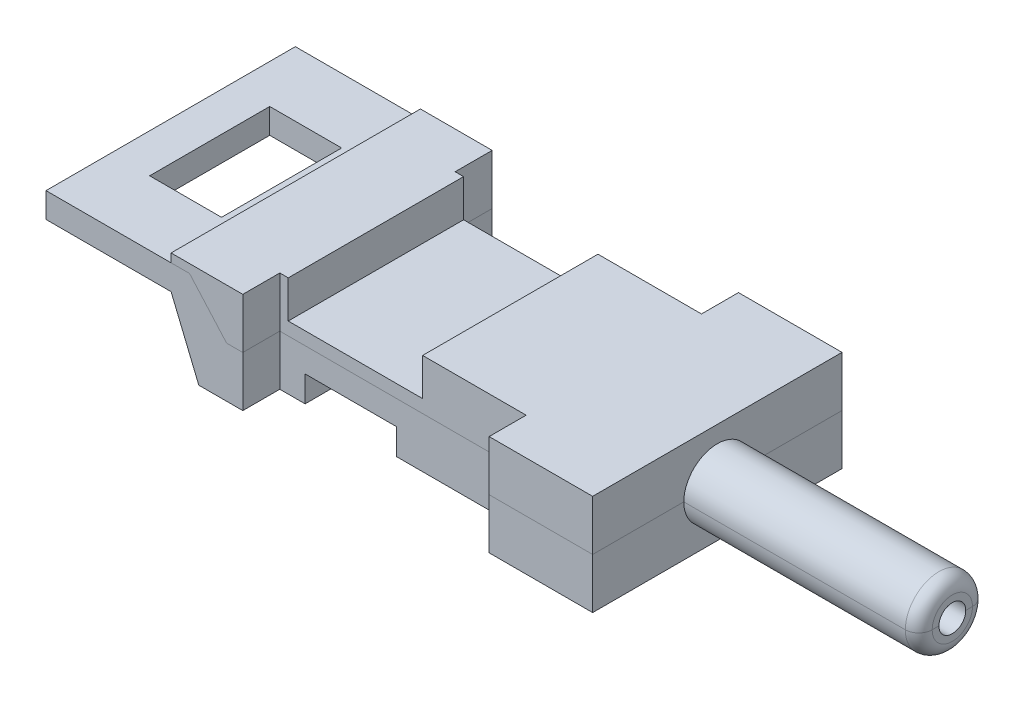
SolidWorks part; units mm, degrees
ref_plane "Ebene vorne" through (0, 0, 0) normal (0, 0, 1) x (1, 0, 0)
ref_plane "Ebene oben" through (0, 0, 0) normal (0, 1, 0) x (1, 0, 0)
ref_plane "Ebene rechts" through (0, 0, 0) normal (1, 0, 0) x (0, 0, -1)
sketch "Skizze1" plane through (0, 0, 0) normal (0, 1, 0) x (1, 0, 0)
  line L0 (40.7087, 0) -> (-40.7087, 0) construction
  line L1 (-40.7087, 18.5695) -> (40.7087, 18.5695)
  line L2 (-40.7087, 18.5695) -> (-40.7087, -18.5695)
  line L3 (-40.7087, -18.5695) -> (40.7087, -18.5695)
  line L4 (40.7087, 18.5695) -> (40.7087, -18.5695)
extrude "Linear austragen1" add sketch "Skizze1" along normal blind 5 and the other way blind 10
sketch "Skizze2" plane through (0, 0, 18.5695) normal (0, 0, 1) x (1, 0, 0)
  line L0 (-40.7087, 0) -> (-22.0775, 0)
  line L1 (-40.7087, 5) -> (-40.7087, -10) construction
  line L2 (-22.0775, 0) -> (-17.9491, -10)
  line L3 (-40.7087, -10) -> (40.7087, -10) construction
  line L4 (-10.1413, 5) -> (-10.1413, -0.5705)
  line L5 (-40.7087, 5) -> (40.7087, 5) construction
  line L6 (-10.1413, -0.5705) -> (9.872, -0.5705)
  line L7 (9.872, -0.5705) -> (9.872, 5)
  line L8 (-7.6284, -10) -> (-7.6284, -6.1347)
  line L9 (-7.6284, -6.1347) -> (6.013, -6.1347)
  line L10 (6.013, -6.1347) -> (6.013, -10)
  line L11 (-10.1413, 5) -> (9.872, 5)
  line L12 (-7.6284, -10) -> (6.013, -10)
  line L13 (-17.9491, -10) -> (-40.7087, -10)
  line L14 (-40.7087, -10) -> (-40.7087, 0)
extrude "Schnitt-Linear austragen1" cut sketch "Skizze2" against normal through all
sketch "Skizze3" plane through (0, 5, 0) normal (0, 1, 0) x (-1, 0, 0)
  line L0 (0, 0) -> (40.7087, 0) construction
  line L1 (34.9005, -8.9429) -> (24.1926, -8.9429)
  line L2 (34.9005, -8.9429) -> (34.9005, 8.9429)
  line L3 (34.9005, 8.9429) -> (24.1926, 8.9429)
  line L4 (24.1926, -8.9429) -> (24.1926, 8.9429)
  line L5 (40.7087, -18.5695) -> (40.7087, 18.5695) construction
  line L6 (-25.2903, 18.5695) -> (-25.2903, 13.058)
  line L7 (-9.872, 18.5695) -> (-40.7087, 18.5695) construction
  line L8 (-25.2903, -18.5695) -> (-25.2903, -13.058)
  line L9 (-25.2903, 13.058) -> (11.3977, 13.058)
  line L10 (-25.2903, -13.058) -> (11.3977, -13.058)
  line L11 (11.3977, 13.058) -> (11.3977, 18.5695)
  line L12 (40.7087, 18.5695) -> (10.1413, 18.5695) construction
  line L13 (11.3977, -13.058) -> (11.3977, -18.5695)
  line L14 (11.3977, 18.5695) -> (-25.2903, 18.5695)
  line L15 (11.3977, -18.5695) -> (-25.2903, -18.5695)
extrude "Schnitt-Linear austragen2" cut sketch "Skizze3" against normal up to next
sketch "Skizze4" plane through (40.7087, 0, 0) normal (1, 0, 0) x (0, 0, -1)
  line L0 (0, -10) -> (0, 5) construction
  line L1 (-18.5695, -10) -> (18.5695, -10) construction
  line L2 (-18.5695, 5) -> (18.5695, 5) construction
  circle A0 centre (0, -2.5) radius 5
  dimension "D1" = 10
extrude "Linear austragen2" add sketch "Skizze4" along normal blind 35
sketch "Skizze6" plane through (0, -10, 0) normal (0, -1, 0) x (1, 0, 0)
  line L0 (40.7087, -5) -> (75.7087, -5) construction
  line L1 (37.7087, 5) -> (28.7663, 5)
  line L2 (37.7087, 5) -> (37.7087, -5)
  line L3 (37.7087, -5) -> (28.7663, -5)
  line L4 (28.7663, 5) -> (28.7663, -5)
  line L5 (75.7087, 5) -> (40.7087, 5) construction
  line L6 (40.7087, 18.5695) -> (40.7087, -18.5695) construction
  dimension "D1" = 3
extrude "Schnitt-Linear austragen3" cut sketch "Skizze6" against normal blind 10
sketch "Skizze5" plane through (75.7087, 0, 0) normal (1, 0, 0) x (0, 0, -1)
  circle A0 centre (0, -2.5) radius 2
extrude "Schnitt-Linear austragen4" cut sketch "Skizze5" against normal up to next
fillet "Verrundung1" radius 2 1 edges at (75.7087, -2.5, -5)
sketch "Skizze8" plane through (0, 0, 18.5695) normal (0, 0, 1) x (1, 0, 0)
  line L0 (-40.7087, 3.7238) -> (-22.0775, 3.7238)
  line L1 (-40.7087, 5) -> (-40.7087, 0) construction
  line L2 (-22.0775, 3.7238) -> (-22.0775, 5)
  line L3 (-40.7087, 5) -> (-11.3977, 5) construction
extrude "Schnitt-Linear austragen5" cut sketch "Skizze8" against normal through all
sketch "Formtrennung" plane through (0, 0, 18.5695) normal (0, 0, 1) x (1, 0, 0)
  line L0 (-40.7087, 3.7238) -> (-19.3296, 3.7238)
  line L1 (75.7087, -2.5) -> (-13.8115, -2.5)
  line L2 (75.7087, -5.5) -> (75.7087, 0.5) construction
  line L3 (-13.8115, -2.5) -> (-19.3296, 3.7238)
